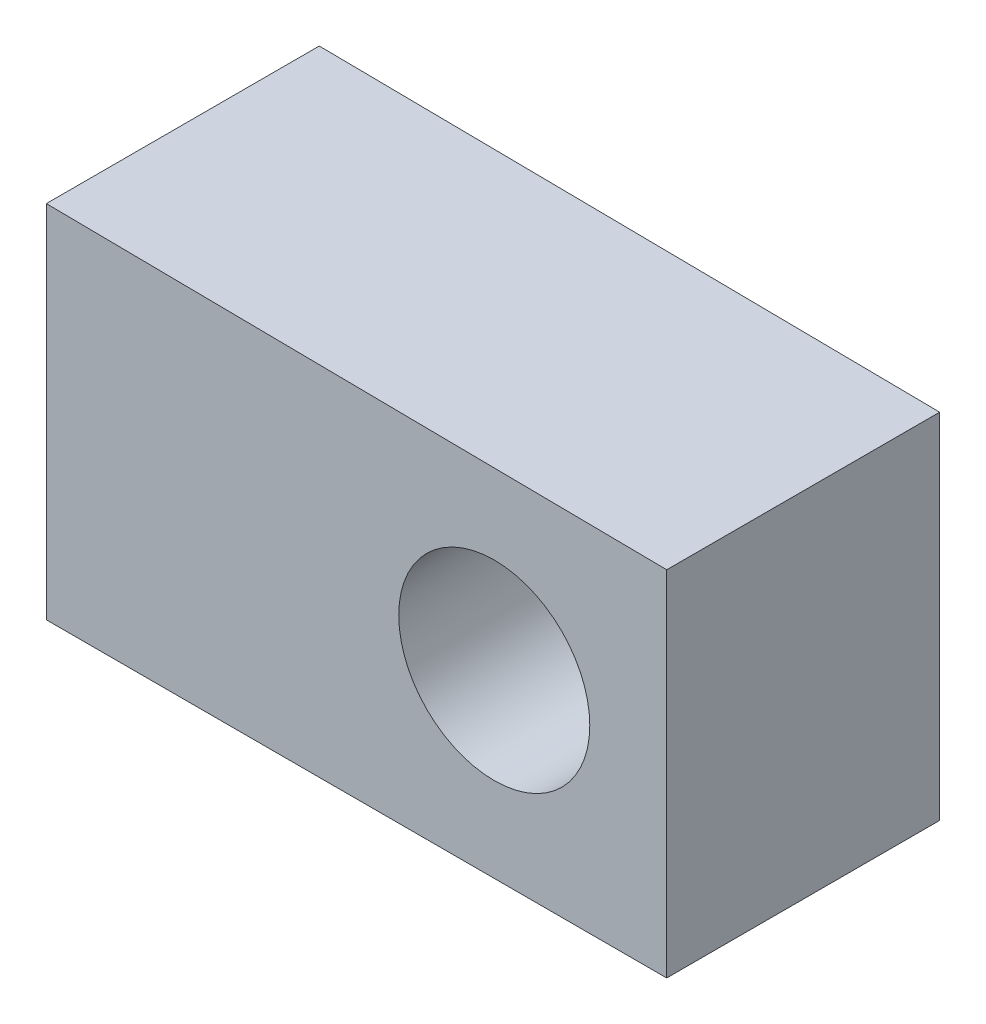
SolidWorks part; units mm, degrees
ref_plane "Plan de face" through (0, 0, 0) normal (0, 0, 1) x (1, 0, 0)
ref_plane "Plan de dessus" through (0, 0, 0) normal (0, 1, 0) x (1, 0, 0)
ref_plane "Plan de droite" through (0, 0, 0) normal (1, 0, 0) x (0, 0, -1)
sketch "Esquisse1" plane through (0, 0, 0) normal (0, 0, 1) x (1, 0, 0)
  line L3 (31541.5958, 62891.4952) -> (31541.5958, 62878.5412)
  line L4 (31518.8657, 62878.5412) -> (31518.8657, 62891.7492)
  line L5 (31541.5958, 62878.5412) -> (31518.8657, 62878.5412)
  line L6 (31518.8657, 62891.7492) -> (31541.5958, 62891.4952)
  circle A1 centre (31535.2771, 62885.1454) radius 3.5
extrude "Boss.-Extru.1" add sketch "Esquisse1" along normal blind 10
